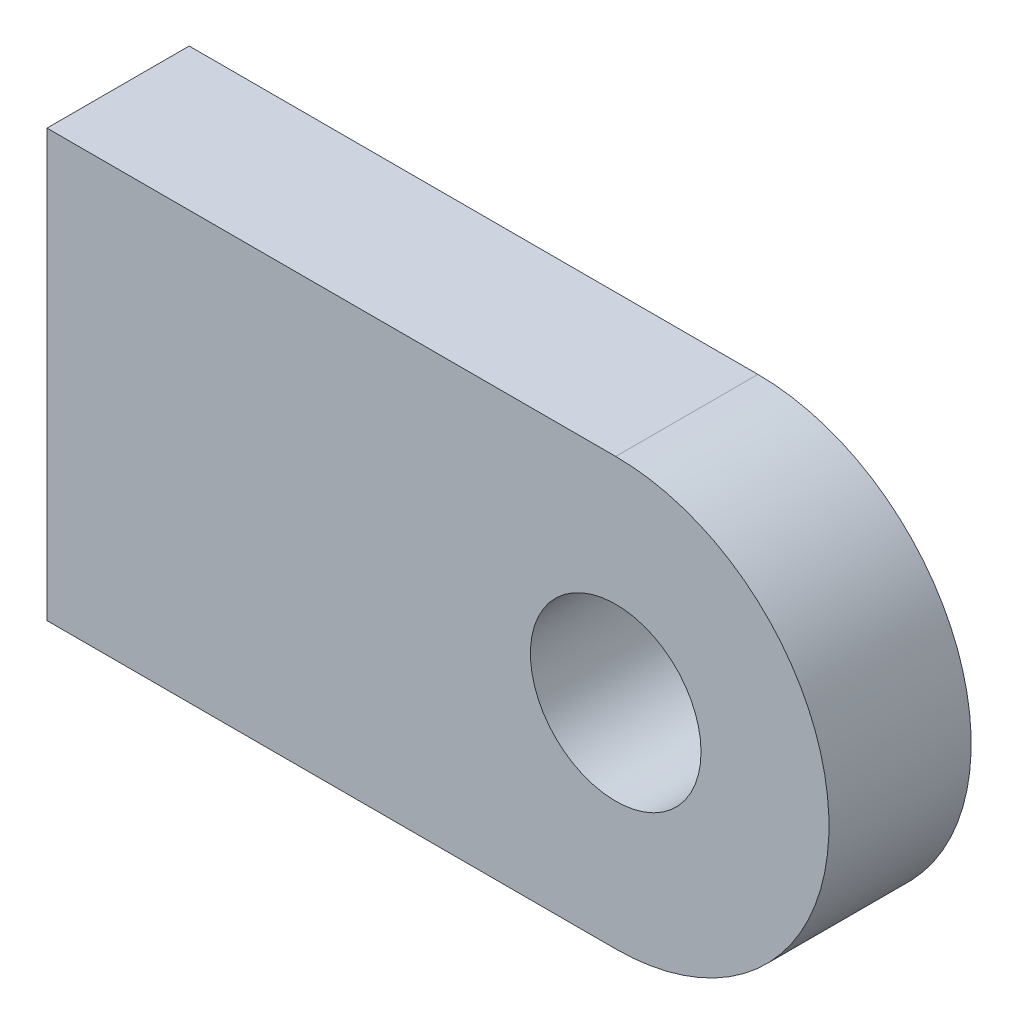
SolidWorks part; units mm, degrees
ref_plane "Face" through (0, 0, 0) normal (0, 0, 1) x (1, 0, 0)
ref_plane "Dessus" through (0, 0, 0) normal (0, 1, 0) x (1, 0, 0)
ref_plane "Droite" through (0, 0, 0) normal (1, 0, 0) x (0, 0, -1)
sketch "Esquisse1" plane through (0, 0, 0) normal (0, 0, 1) x (1, 0, 0)
  line L1 (0, 0) -> (40, 0)
  line L2 (0, 0) -> (0, -30)
  line L3 (0, -30) -> (40, -30)
  arc A0 (40, -30) -> (40, 0) centre (40, -15) ccw
  dimension "D1" = 30
  dimension "D2" = 40
extrude "Extrusion1" add sketch "Esquisse1" along normal blind 10
sketch "Esquisse2" plane through (0, 0, 10) normal (0, 0, 1) x (1, 0, 0)
  circle A0 centre (40, -15) radius 6
extrude "Enlèv. mat.-Extru.1" cut sketch "Esquisse2" against normal blind 10
